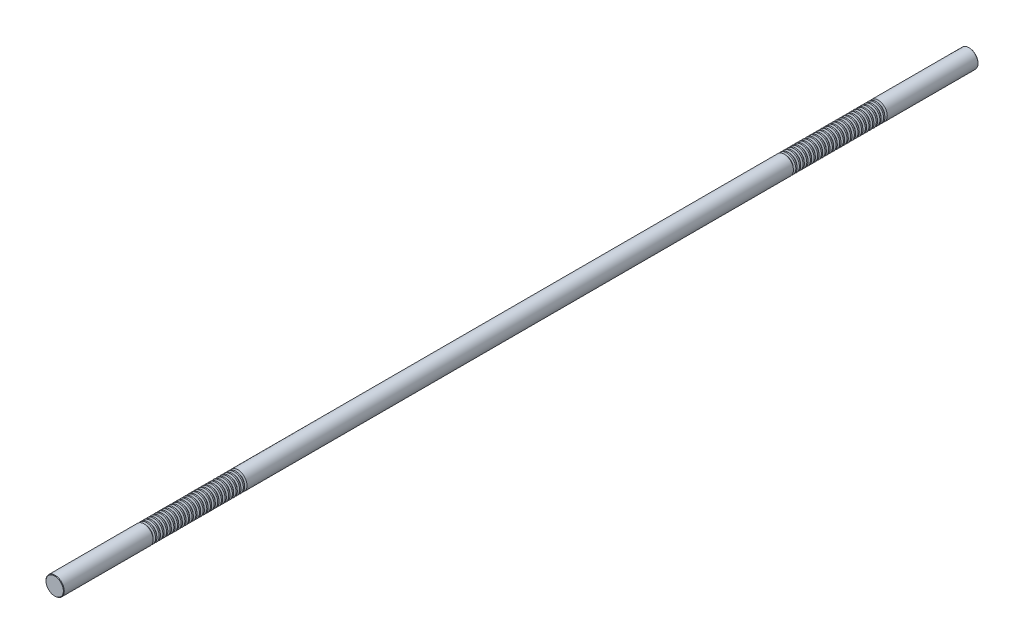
SolidWorks part; units mm, degrees
ref_plane "Front Plane" through (0, 0, 0) normal (0, 0, 1) x (1, 0, 0)
ref_plane "Top Plane" through (0, 0, 0) normal (0, 1, 0) x (1, 0, 0)
ref_plane "Right Plane" through (0, 0, 0) normal (1, 0, 0) x (0, 0, -1)
sketch "Sketch1" plane through (0, 0, 0) normal (0, 0, 1) x (1, 0, 0)
  circle A0 centre (0, 0) radius 10
  dimension "D1" = 20
extrude "Boss-Extrude1" add sketch "Sketch1" along normal mid plane 1000
chamfer "Chamfer1" distance 0.5 angle 45 2 edges at (10, 0, -500) (10, 0, 500)
sketch "Sketch2" plane through (0, 0, 0) normal (1, 0, 0) x (0, 0, -1)
  line L0 (400.3014, 10) -> (397.6986, 10)
  line L1 (499.5, 10) -> (-499.5, 10) construction
  line L2 (397.6986, 10) -> (398.3014, 7.75)
  line L3 (398.3014, 7.75) -> (399.6986, 7.75)
  line L4 (399.6986, 7.75) -> (400.3014, 10)
  line L5 (500, -9.5) -> (500, 9.5) construction
  point P4 (399, 10)
  point P7 (399, 7.75)
  point P8 (400, 8.875)
  point P9 (398, 8.875)
  dimension "D1" = 2
  dimension "D2" = 100
  dimension "D3" = 2.25
  dimension "D4" = 30
revolve "Cut-Revolve1" cut sketch "Sketch2" angle 360 about axis through (0, 0, 500) along (0, 0, -1)
pattern_linear "LPattern1" count 26 spacing 4 along (0, 0, 1) of "Cut-Revolve1"
pattern_linear "LPattern2" count 2 spacing 700 along (0, 0, 1) of "Cut-Revolve1", "LPattern1"
